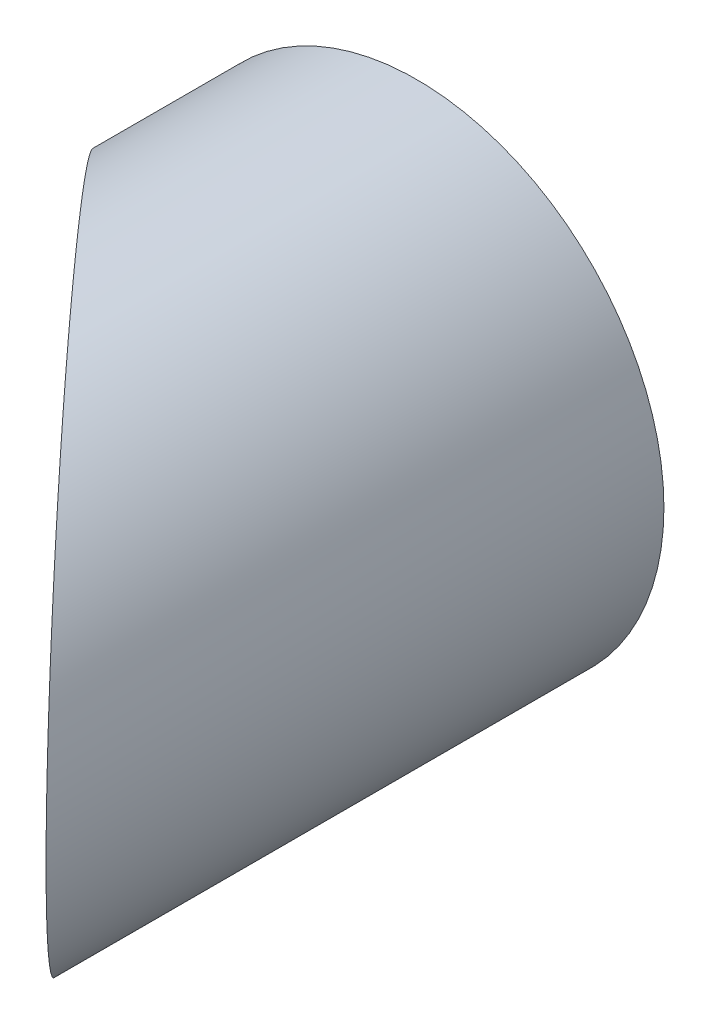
SolidWorks part; units mm, degrees
ref_plane "Front Plane" through (0, 0, 0) normal (0, 0, 1) x (1, 0, 0)
ref_plane "Top Plane" through (0, 0, 0) normal (0, 1, 0) x (1, 0, 0)
ref_plane "Right Plane" through (0, 0, 0) normal (1, 0, 0) x (0, 0, -1)
sketch "Sketch1" plane through (0, 0, 0) normal (0, 0, 1) x (1, 0, 0)
  circle A0 centre (0, 0) radius 9.525
  circle A1 centre (0, 0) radius 3.9878
  dimension "D1" = 19.05
  dimension "D2" = 7.9756
extrude "Boss-Extrude1" add sketch "Sketch1" along normal blind 23.8125
sketch "Sketch2" plane through (0, 0, 0) normal (0, 1, 0) x (1, 0, 0)
  line L0 (9.525, -23.8125) -> (-13.9014, 2.2051)
  line L1 (9.525, -23.8125) -> (-13.9014, -23.8125)
  line L2 (-13.9014, -23.8125) -> (-13.9014, 2.2051)
  dimension "D1" = 48
extrude "Cut-Extrude1" cut sketch "Sketch2" against normal through all and the other way through all
equation "\"Buoyancy\"=\"SW-Volume\"*(\"SW-Density\"-.037062)"
